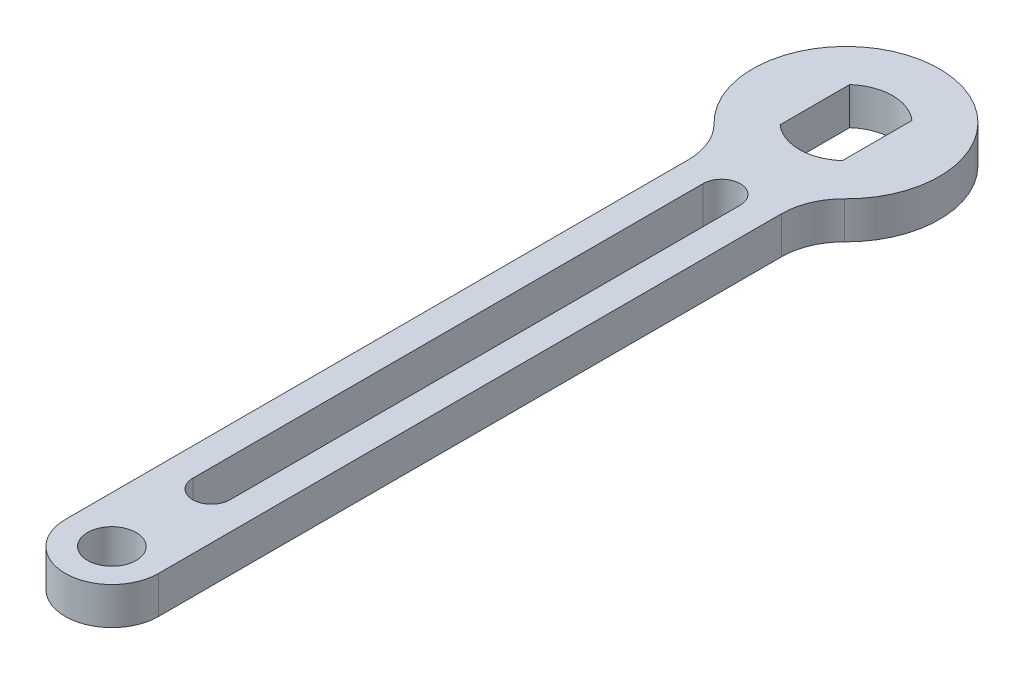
SolidWorks part; units mm, degrees
ref_plane "Plan de face" through (0, 0, 0) normal (0, 0, 1) x (1, 0, 0)
ref_plane "Plan de dessus" through (0, 0, 0) normal (0, 1, 0) x (1, 0, 0)
ref_plane "Plan de droite" through (0, 0, 0) normal (1, 0, 0) x (0, 0, -1)
sketch "Esquisse1" plane through (0, 0, 0) normal (0, 1, 0) x (1, 0, 0)
  line L0 (-5, -5.5902) -> (-5, 5.5902)
  line L1 (5, 5.5902) -> (5, -5.5902)
  line L2 (-7.5, -12.9904) -> (-7.5, -118)
  line L3 (0, 19.7086) -> (0, -132.8862) construction
  line L4 (7.5, -12.9904) -> (7.5, -118)
  line L5 (0, -20) -> (0, -102) construction
  line L6 (3, -20) -> (3, -102)
  line L7 (-3, -20) -> (-3, -102)
  arc A0 (7.5, -12.9904) -> (-7.5, -12.9904) centre (0, 0) ccw
  arc A2 (-7.5, -118) -> (7.5, -118) centre (0, -118) ccw
  circle A3 centre (0, -118) radius 3.9
  arc A4 (-5, -5.5902) -> (5, -5.5902) centre (0, 0) ccw
  arc A5 (5, 5.5902) -> (-5, 5.5902) centre (0, 0) ccw
  arc A6 (3, -20) -> (-3, -20) centre (0, -20) ccw
  arc A7 (-3, -102) -> (3, -102) centre (0, -102) ccw
  point P4 (7.5, -12.9904)
  point P5 (-7.5, -12.9904)
  point P19 (0, -61)
  dimension "D2" = 30
  dimension "D4" = 10
  dimension "D8" = 15
  dimension "D9" = 7.8
  dimension "D12" = 15
  dimension "D5" = 118
  dimension "D13" = 6
  dimension "D14" = 20
  dimension "D15" = 16
extrude "Extrusion1" add sketch "Esquisse1" against normal blind 6
fillet "Congé1" radius 10 2 edges at (-7.5, -3, 12.9904) (7.5, -3, 12.9904)
